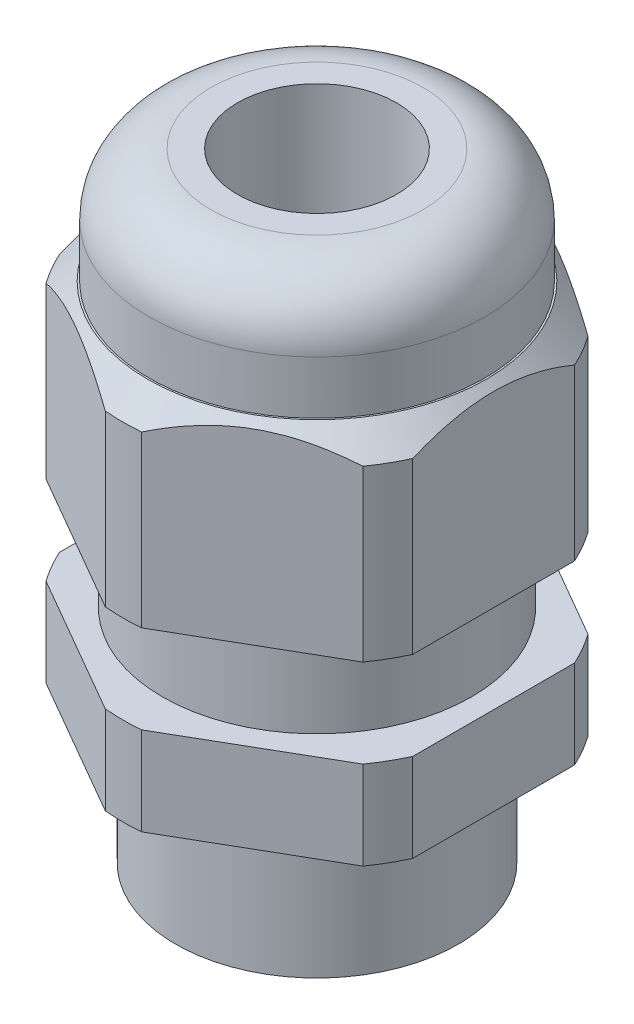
SolidWorks part; units mm, degrees
ref_plane "Face" through (0, 0, 0) normal (0, 0, 1) x (1, 0, 0)
ref_plane "Dessus" through (0, 0, 0) normal (0, 1, 0) x (1, 0, 0)
ref_plane "Droite" through (0, 0, 0) normal (1, 0, 0) x (0, 0, -1)
sketch "Esquisse1" plane through (0, 0, 0) normal (0, 0, 1) x (1, 0, 0)
  line L0 (0, 0) -> (0, 72.5436) construction
  line L1 (5.5, 0) -> (8, 0)
  line L2 (8, 0) -> (8, 7.5)
  line L3 (8, 7.5) -> (11, 7.5)
  line L4 (11, 7.5) -> (11, 12.5)
  line L5 (11, 12.5) -> (8.75, 12.5)
  line L6 (8.75, 12.5) -> (8.75, 17.5)
  line L7 (8.75, 17.5) -> (11, 17.5)
  line L8 (11, 17.5) -> (11, 28.5)
  line L9 (11, 28.5) -> (9.5, 28.5)
  line L10 (9.5, 28.5) -> (9.5, 35)
  line L11 (9.5, 35) -> (4.5, 35)
  line L12 (5.5, 0) -> (5.5, 24.0548)
  line L13 (5.5, 24.0548) -> (4.5, 24.0548)
  line L14 (4.5, 24.0548) -> (4.5, 35)
  dimension "D1" = 7.5
  dimension "D2" = 16
  dimension "D3" = 22
  dimension "D4" = 5
  dimension "D5" = 5
  dimension "D6" = 17.5
  dimension "D7" = 22
  dimension "D8" = 19
  dimension "D9" = 11
  dimension "D10" = 35
  dimension "D11" = 9
  dimension "D12" = 11
revolve "Révolution1" add sketch "Esquisse1" angle 360 about L0
fillet "Congé1" radius 3.5 1 edges at (0, 35, -9.5)
chamfer "Chanfrein2" distance 1.4 angle 45 1 edges at (0, 28.5, -11)
sketch "Esquisse2" plane through (0, 28.5, 0) normal (0, 1, 0) x (-1, 0, 0)
  line L1 (-10, 5.7735) -> (-10, -5.7735)
  line L2 (-10, -5.7735) -> (0, -11.547)
  line L3 (0, -11.547) -> (10, -5.7735)
  line L4 (10, -5.7735) -> (10, 5.7735)
  line L5 (10, 5.7735) -> (0, 11.547)
  line L6 (0, 11.547) -> (-10, 5.7735)
  circle A0 centre (0, 0) radius 10 construction
  dimension "D1" = 20
extrude "Enlèv. mat.-Extru.1" cut sketch "Esquisse2" against normal through all flip side to cut
